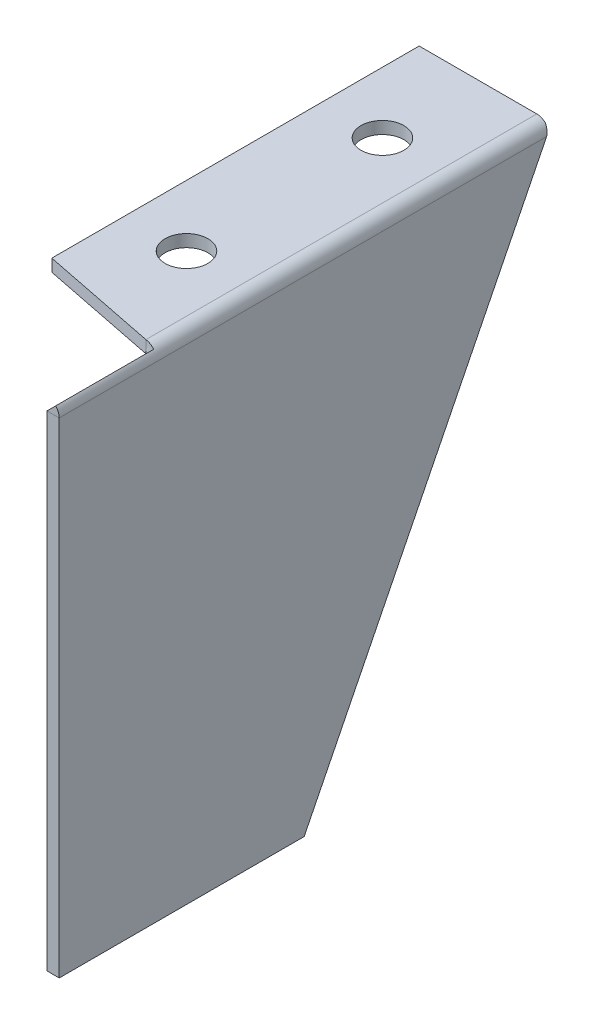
SolidWorks part; units mm, degrees
ref_plane "Front Plane" through (0, 0, 0) normal (0, 0, 1) x (1, 0, 0)
ref_plane "Top Plane" through (0, 0, 0) normal (0, 1, 0) x (1, 0, 0)
ref_plane "Right Plane" through (0, 0, 0) normal (1, 0, 0) x (0, 0, -1)
sketch "Sketch1" plane through (0, 0, 0) normal (0, 1, 0) x (1, 0, 0)
  line L0 (0, 0) -> (10, 0)
  line L1 (10, 0) -> (50, -20)
  line L2 (50, -20) -> (50, -40)
  line L3 (50, -40) -> (10, -40)
  line L4 (10, -40) -> (10, -32)
  line L5 (10, -32) -> (0, -30)
  line L6 (0, -30) -> (0, 0)
  line L7 (10, 0) -> (10, -32) construction
  line L8 (5, 0) -> (5, -31) construction
  circle A0 centre (5, -8) radius 1.75
  circle A1 centre (5, -24) radius 1.75
  dimension "D7" = 8
  dimension "D8" = 16
  dimension "D9" = 3.5
  dimension "D1" = 20
  dimension "D2" = 40
  dimension "D3" = 10
  dimension "D4" = 40
  dimension "D5" = 10
  dimension "D6" = 8
sheet metal parameters "Sheet-Metal1" thickness 1 parameters "D1"=0.7366
base flange "Base-Flange1" sketch "Sketch1" thickness 1 reverse thickness direction yes parameters "D1"=0.7366
sketch "Sketch3" plane through (0, 1, 0) normal (0, 1, 0) x (1, 0, 0)
  line L0 (10, -32) -> (10, 0)
sketched bend "Sketched Bend1" parameters "D1"=0.001
bend "SketchBend1" bend radius 0.001 bend angle 90 parameters "D5"=1
flat pattern "Flat-Pattern1"
sketch "Bend-Lines1" plane through (0, 1, 0) normal (0, 1, 0) x (-1, 0, 0)
  line L0 (-10, 0) -> (-10, 40) construction
sketch3d "Bounding-Box1" [suppressed]
  line L0 (-50, 0, 0) -> (0, 0, 0) construction
  line L1 (-50, 40, 0) -> (0, 40, 0) construction
  line L2 (-50, 0, 0) -> (-50, 40, 0) construction
  line L3 (0, 0, 0) -> (0, 40, 0) construction
